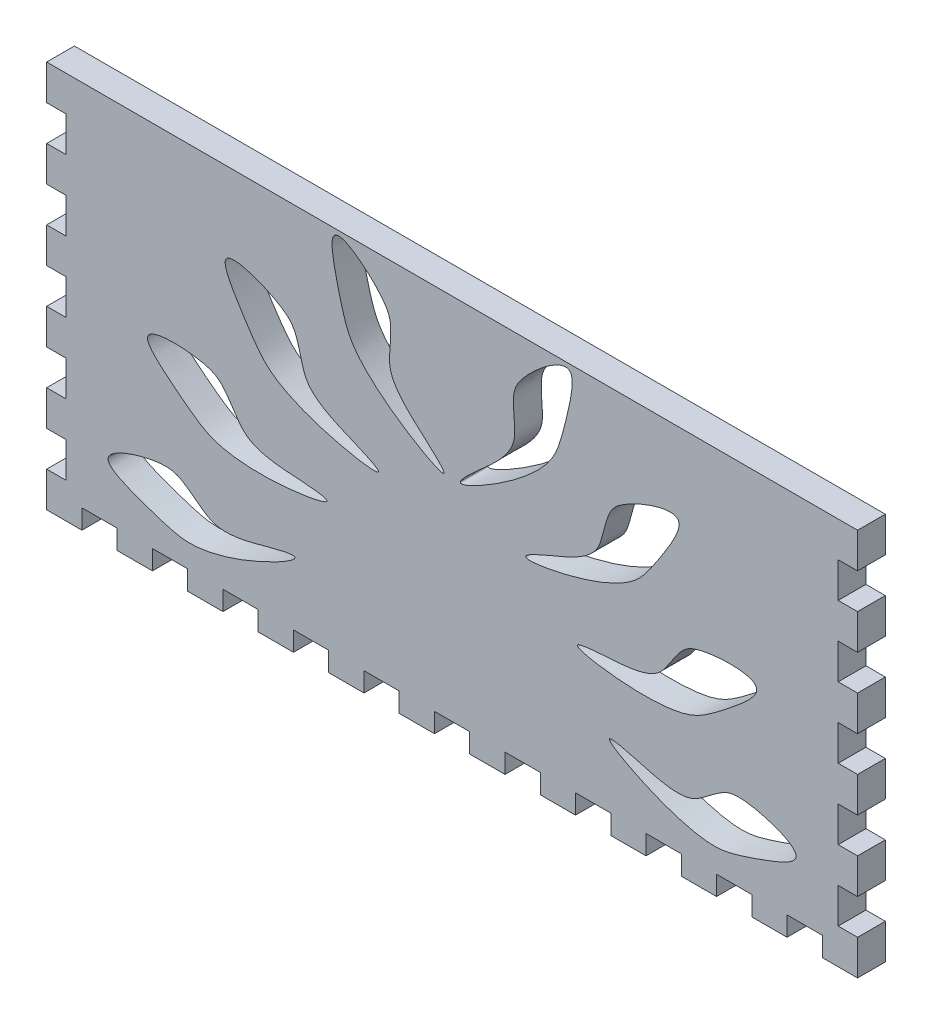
SolidWorks part; units mm, degrees
ref_plane "Front Plane" through (0, 0, 0) normal (0, 0, 1) x (1, 0, 0)
ref_plane "Top Plane" through (0, 0, 0) normal (0, 1, 0) x (1, 0, 0)
ref_plane "Right Plane" through (0, 0, 0) normal (1, 0, 0) x (0, 0, -1)
sketch "Sketch1" plane through (0, 0, 0) normal (0, 0, 1) x (1, 0, 0)
  line L0 (-53.34, -27.94) -> (-53.34, -25.146)
  line L1 (-58.42, 27.94) -> (58.42, 27.94)
  line L2 (-58.42, -12.7) -> (-55.626, -12.7)
  line L3 (-58.42, -27.94) -> (-53.34, -27.94)
  line L4 (58.42, -22.86) -> (58.42, -27.94)
  line L5 (-58.42, 27.94) -> (58.42, -27.94) construction
  line L6 (-58.42, -27.94) -> (58.42, 27.94) construction
  line L7 (-53.34, -25.146) -> (-48.26, -25.146)
  line L8 (-48.26, -25.146) -> (-48.26, -27.94)
  line L9 (-38.1, -25.146) -> (-38.1, -27.94)
  line L10 (-43.18, -25.146) -> (-38.1, -25.146)
  line L11 (-43.18, -27.94) -> (-43.18, -25.146)
  line L12 (-48.26, -27.94) -> (-43.18, -27.94)
  line L13 (-27.94, -25.146) -> (-27.94, -27.94)
  line L14 (-33.02, -25.146) -> (-27.94, -25.146)
  line L15 (-33.02, -27.94) -> (-33.02, -25.146)
  line L16 (-38.1, -27.94) -> (-33.02, -27.94)
  line L17 (-17.78, -25.146) -> (-17.78, -27.94)
  line L18 (-22.86, -25.146) -> (-17.78, -25.146)
  line L19 (-22.86, -27.94) -> (-22.86, -25.146)
  line L20 (-27.94, -27.94) -> (-22.86, -27.94)
  line L21 (-7.62, -25.146) -> (-7.62, -27.94)
  line L22 (-12.7, -25.146) -> (-7.62, -25.146)
  line L23 (-12.7, -27.94) -> (-12.7, -25.146)
  line L24 (-17.78, -27.94) -> (-12.7, -27.94)
  line L25 (2.54, -25.146) -> (2.54, -27.94)
  line L26 (-2.54, -25.146) -> (2.54, -25.146)
  line L27 (-2.54, -27.94) -> (-2.54, -25.146)
  line L28 (-7.62, -27.94) -> (-2.54, -27.94)
  line L29 (12.7, -25.146) -> (12.7, -27.94)
  line L30 (7.62, -25.146) -> (12.7, -25.146)
  line L31 (7.62, -27.94) -> (7.62, -25.146)
  line L32 (2.54, -27.94) -> (7.62, -27.94)
  line L33 (22.86, -25.146) -> (22.86, -27.94)
  line L34 (17.78, -25.146) -> (22.86, -25.146)
  line L35 (17.78, -27.94) -> (17.78, -25.146)
  line L36 (12.7, -27.94) -> (17.78, -27.94)
  line L37 (33.02, -25.146) -> (33.02, -27.94)
  line L38 (27.94, -25.146) -> (33.02, -25.146)
  line L39 (27.94, -27.94) -> (27.94, -25.146)
  line L40 (22.86, -27.94) -> (27.94, -27.94)
  line L41 (43.18, -25.146) -> (43.18, -27.94)
  line L42 (38.1, -25.146) -> (43.18, -25.146)
  line L43 (38.1, -27.94) -> (38.1, -25.146)
  line L44 (33.02, -27.94) -> (38.1, -27.94)
  line L45 (53.34, -25.146) -> (53.34, -27.94)
  line L46 (48.26, -25.146) -> (53.34, -25.146)
  line L47 (48.26, -27.94) -> (48.26, -25.146)
  line L48 (43.18, -27.94) -> (48.26, -27.94)
  line L49 (53.34, -27.94) -> (58.42, -27.94)
  line L50 (-58.42, -22.86) -> (-55.626, -22.86)
  line L51 (-55.626, -22.86) -> (-55.626, -17.78)
  line L52 (-55.626, -17.78) -> (-58.42, -17.78)
  line L53 (-58.42, -22.86) -> (-58.42, -27.94)
  line L54 (-55.626, -12.7) -> (-55.626, -7.62)
  line L55 (-55.626, -7.62) -> (-58.42, -7.62)
  line L56 (-58.42, -12.7) -> (-58.42, -17.78)
  line L57 (-58.42, -2.54) -> (-55.626, -2.54)
  line L58 (-55.626, -2.54) -> (-55.626, 2.54)
  line L59 (-55.626, 2.54) -> (-58.42, 2.54)
  line L60 (-58.42, -2.54) -> (-58.42, -7.62)
  line L61 (-58.42, 7.62) -> (-55.626, 7.62)
  line L62 (-55.626, 7.62) -> (-55.626, 12.7)
  line L63 (-55.626, 12.7) -> (-58.42, 12.7)
  line L64 (-58.42, 7.62) -> (-58.42, 2.54)
  line L65 (-58.42, 17.78) -> (-55.626, 17.78)
  line L66 (-55.626, 17.78) -> (-55.626, 22.86)
  line L67 (-55.626, 22.86) -> (-58.42, 22.86)
  line L68 (-58.42, 17.78) -> (-58.42, 12.7)
  line L69 (-58.42, 22.86) -> (-58.42, 27.94)
  line L70 (0, 0) -> (0, 27.94) construction
  line L71 (58.42, 22.86) -> (58.42, 27.94)
  line L72 (58.42, 17.78) -> (58.42, 12.7)
  line L73 (55.626, 22.86) -> (58.42, 22.86)
  line L74 (55.626, 17.78) -> (55.626, 22.86)
  line L75 (58.42, 17.78) -> (55.626, 17.78)
  line L76 (58.42, 7.62) -> (58.42, 2.54)
  line L77 (55.626, 12.7) -> (58.42, 12.7)
  line L78 (55.626, 7.62) -> (55.626, 12.7)
  line L79 (58.42, 7.62) -> (55.626, 7.62)
  line L80 (58.42, -2.54) -> (58.42, -7.62)
  line L81 (55.626, 2.54) -> (58.42, 2.54)
  line L82 (55.626, -2.54) -> (55.626, 2.54)
  line L83 (58.42, -2.54) -> (55.626, -2.54)
  line L84 (58.42, -12.7) -> (58.42, -17.78)
  line L85 (55.626, -7.62) -> (58.42, -7.62)
  line L86 (55.626, -12.7) -> (55.626, -7.62)
  line L87 (55.626, -17.78) -> (58.42, -17.78)
  line L88 (55.626, -22.86) -> (55.626, -17.78)
  line L89 (58.42, -22.86) -> (55.626, -22.86)
  line L90 (58.42, -12.7) -> (55.626, -12.7)
  point P0 (0, 0)
  dimension "D1" = 116.84
  dimension "D2" = 55.88
  dimension "D3" = 2.794
  dimension "D4" = 5.08
  dimension "D5" = 5.08
  dimension "D6" = 5.08
  dimension "D7" = 5.08
  dimension "D8" = 11
  dimension "D9" = 5
extrude "Boss-Extrude1" add sketch "Sketch1" along normal blind 4
sketch "Sketch2" plane through (0, 0, 4) normal (0, 0, 1) x (1, 0, 0)
  line L0 (0, 0) -> (0, -25.146) construction
  line L1 (-2.54, -25.146) -> (2.54, -25.146) construction
  spline S0 degree 3 poles (19.6036, -14.989) (26.6971, -16.5709) (33.3131, -18.631) (38.7542, -14.6084) (40.6202, -12.8881) (53.1655, -16.7963) (45.1511, -19.9343) (40.0057, -21.655) (37.0975, -22.2099) (27.9874, -19.563) (19.6036, -14.989) (26.6971, -16.5709) (33.3131, -18.631) knots -0.259528 -0.224396 -0.061846 0 0.085894 0.109582 0.236881 0.405004 0.508251 0.586835 0.740472 0.775604 0.938154 1 1.085894 1.109582 1.236881 only from (26.5547, -16.6275) to (26.5547, -16.6275)
extrude "Cut-Extrude1" cut sketch "Sketch2" against normal through all
pattern_circular "CirPattern2" count 4 every 19 about axis through (-7.62, -25.146, 4) along (0, 0, -1) of "Cut-Extrude1"
mirror "Mirror3" about plane through (0, 0, 0) normal (1, 0, 0) of "CirPattern2", "Cut-Extrude1"
